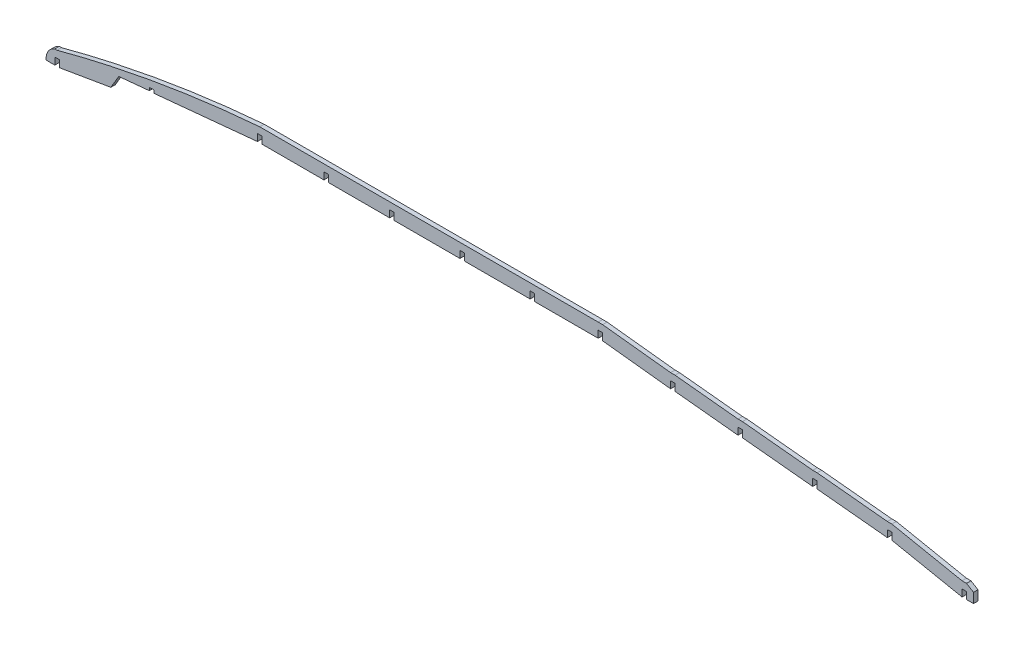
SolidWorks part; units mm, degrees
ref_plane "Front Plane" through (0, 0, 0) normal (0, 0, 1) x (1, 0, 0)
ref_plane "Top Plane" through (0, 0, 0) normal (0, 1, 0) x (1, 0, 0)
ref_plane "Right Plane" through (0, 0, 0) normal (1, 0, 0) x (0, 0, -1)
sketch "Sketch1" plane through (0, 0, 0) normal (0, 0, 1) x (1, 0, 0)
  line L0 (0, 0) -> (0, 45) construction
  line L1 (0, 45) -> (3.175, 45)
  line L2 (3.175, 45) -> (3.175, 0) construction
  line L3 (3.175, 0) -> (53.175, 0) construction
  line L4 (53.175, 0) -> (53.175, 40) construction
  line L5 (53.175, 40) -> (56.35, 40)
  line L6 (56.35, 40) -> (56.35, 0) construction
  line L7 (56.35, 0) -> (106.35, 0) construction
  line L8 (106.35, 0) -> (106.35, 35) construction
  line L9 (106.35, 35) -> (109.525, 35)
  line L10 (109.525, 35) -> (109.525, 0) construction
  line L11 (109.525, 0) -> (159.525, 0) construction
  line L12 (159.525, 0) -> (159.525, 25) construction
  line L13 (159.525, 25) -> (162.7, 25)
  line L14 (162.7, 25) -> (162.7, 5) construction
  line L15 (0, 45) -> (0, 40)
  line L16 (53.175, 40) -> (53.175, 45) construction
  line L17 (-44.81, 49.612) -> (-47.985, 49.612)
  line L18 (-47.985, 49.612) -> (-47.985, 0) construction
  line L19 (0, 50) -> (3.175, 50)
  line L20 (3.175, 45) -> (3.175, 40)
  line L21 (106.35, 35) -> (106.35, 40) construction
  line L22 (159.525, 25) -> (159.525, 30) construction
  line L23 (3.175, 50) -> (53.175, 45)
  line L24 (53.175, 45) -> (56.35, 45)
  line L25 (56.35, 45) -> (106.35, 40)
  line L26 (106.35, 40) -> (109.525, 40)
  line L27 (53.175, 40) -> (53.175, 35)
  line L28 (159.525, 30) -> (162.7, 30)
  line L29 (3.175, 40) -> (53.175, 35)
  line L30 (56.35, 40) -> (56.35, 35)
  line L31 (56.35, 35) -> (106.35, 30)
  line L32 (106.35, 30) -> (106.35, 35)
  line L33 (162.7, 25) -> (162.7, 20)
  line L34 (162.7, 20) -> (167.7, 20)
  line L35 (167.7, 20) -> (167.7, 27)
  line L36 (109.525, 35) -> (109.525, 30)
  line L37 (109.525, 30) -> (159.525, 20)
  line L38 (159.525, 20) -> (159.525, 25)
  line L39 (162.7, 30) -> (167.7, 27)
  line L40 (0, 0) -> (-44.81, 0) construction
  line L41 (-44.81, 0) -> (-44.81, 49.612) construction
  line L42 (-44.81, 49.612) -> (-44.81, 44.612)
  line L43 (-44.81, 44.612) -> (0, 40)
  line L44 (109.525, 40) -> (159.525, 30)
  line L45 (-47.985, 49.612) -> (-47.985, 44.612)
  line L46 (-44.81, 49.612) -> (-44.81, 54.612) construction
  line L47 (-96.395, 55) -> (-96.395, 60) construction
  line L48 (-47.985, 0) -> (-96.395, 0) construction
  line L49 (-96.395, 0) -> (-96.395, 50) construction
  line L50 (-96.395, 50) -> (-96.395, 55)
  line L51 (-96.395, 55) -> (-99.57, 55)
  line L52 (-99.57, 55) -> (-99.575, 50)
  line L53 (-99.575, 59.9801) -> (-99.575, 30.1272) construction
  line L54 (-96.395, 50) -> (-47.985, 44.612)
  line L55 (0, 50) -> (-44.81, 54.612)
  line L56 (-44.81, 54.612) -> (-47.985, 54.612)
  line L57 (-47.985, 54.612) -> (-96.395, 60)
  line L58 (-96.395, 60) -> (-99.57, 60)
  line L59 (-99.575, 50) -> (-144.8125, 50)
  line L60 (-144.8125, 50) -> (-144.8125, 55)
  line L62 (-144.8125, 55) -> (-147.9875, 55)
  line L63 (-147.9875, 55) -> (-147.9875, 50)
  line L64 (-147.9875, 50) -> (-194.8125, 50)
  line L65 (-194.8125, 37.5893) -> (-194.8125, 59.9854) construction
  line L66 (-194.8125, 50) -> (-194.8125, 55)
  line L67 (-194.8125, 55) -> (-197.9875, 55)
  line L68 (-197.9875, 55) -> (-197.9875, 50)
  line L69 (-197.9875, 50) -> (-244.8125, 50)
  line L70 (-244.8125, 50) -> (-244.8125, 55)
  line L71 (-244.8125, 55) -> (-247.9875, 55)
  line L72 (-247.9875, 55) -> (-247.9875, 50)
  line L73 (-247.9875, 50) -> (-291.6375, 50)
  line L74 (-291.6375, 50) -> (-291.6375, 55)
  line L75 (-291.6375, 55) -> (-294.8125, 55)
  line L76 (-294.8125, 55) -> (-294.8125, 50)
  line L77 (-294.8125, 50) -> (-338.9875, 50)
  line L78 (-338.9875, 50) -> (-338.9875, 55)
  line L79 (-338.9875, 55) -> (-342.1625, 55)
  line L80 (-342.1625, 55) -> (-342.1625, 50)
  line L81 (-342.1625, 50) -> (-415.975, 42.8752)
  line L82 (-415.975, -49.9748) -> (-415.975, 49.9748) construction
  line L83 (-415.975, 42.8752) -> (-415.975, 45)
  line L84 (-415.975, 45) -> (-419.15, 45)
  line L85 (-419.15, 45) -> (-419.15, 42.8752)
  line L86 (-419.15, 49.9748) -> (-419.15, -49.9748) construction
  line L87 (-483.2624, 1.7517) -> (-483.2624, 34.964) construction
  line L88 (-483.2624, 25) -> (-483.2624, 30)
  line L89 (-483.2624, 30) -> (-486.4374, 30)
  line L90 (-486.4374, 30) -> (-486.4374, 25)
  line L91 (-486.4374, 34.964) -> (-486.4374, 1.7517) construction
  line L92 (-486.4374, 25) -> (-492.6965, 25)
  line L93 (-486.4374, 34.964) -> (-484.8499, 34.964)
  line L94 (-483.2624, 34.964) -> (-486.4374, 34.964) construction
  line L96 (-415.975, 49.9748) -> (-419.15, 49.9748) construction
  line L97 (-338.9875, 59.9099) -> (-342.1625, 59.9099) construction
  line L98 (-419.15, 42.8752) -> (-440.8932, 40.7764)
  line L99 (-440.8932, 40.7764) -> (-446.5281, 31.2579)
  line L100 (-446.5281, 31.2579) -> (-483.2624, 25)
  line L101 (-340.575, 59.9099) -> (-99.57, 60)
  spline S0 degree 2 poles (-492.6965, 25) (-492.7906, 32.2692) (-486.4374, 34.964) knots 0 0 0 1 1 1
  spline S1 degree 2 poles (-484.8499, 34.964) (-413.8679, 54.0138) (-340.575, 59.9099) knots 0 0 0 1 1 1
extrude "Boss-Extrude1" add sketch "Sketch1" along normal blind 3.175
